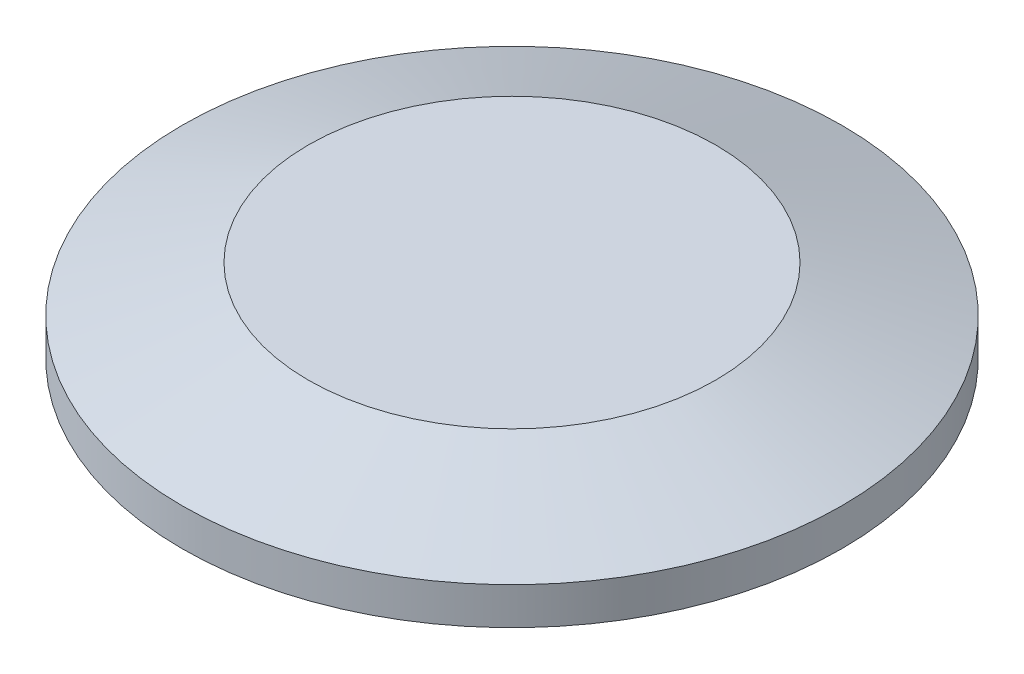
SolidWorks part; units mm, degrees
ref_plane "Front Plane" through (0, 0, 0) normal (0, 0, 1) x (1, 0, 0)
ref_plane "Top Plane" through (0, 0, 0) normal (0, 1, 0) x (1, 0, 0)
ref_plane "Right Plane" through (0, 0, 0) normal (1, 0, 0) x (0, 0, -1)
sketch "Sketch1" plane through (0, 0, 0) normal (0, 0, 1) x (1, 0, 0)
  line L0 (0, 0) -> (-20.0006, 0)
  line L1 (-25.1968, 0) -> (-25.1968, 2.8448)
  line L2 (-25.1968, 2.8448) -> (-15.5663, 6.35)
  line L3 (-15.5663, 6.35) -> (0, 6.35)
  line L4 (0, 6.35) -> (0, 0) construction
  line L5 (-23.6366, 0) -> (-25.1968, 0)
  line L6 (0, 0) -> (0, 6.35)
  arc A0 (-20.7231, 0.4745) -> (-22.9141, 0.4745) centre (-21.8186, 0) ccw
  arc A1 (-20.0006, 0) -> (-20.7231, 0.4745) centre (-20.0006, 0.7874) cw
  arc A2 (-23.6366, 0) -> (-22.9141, 0.4745) centre (-23.6366, 0.7874) ccw
  point P13 (-23.0124, 0)
  dimension "D1" = 2.3876
  dimension "D2" = 0.7874
  dimension "D3" = 25.1968
  dimension "D4" = 21.8186
  dimension "D5" = 2.8448
  dimension "D6" = 20
  dimension "D7" = 6.35
revolve "Revolve1" add sketch "Sketch1" angle 360 about L4
